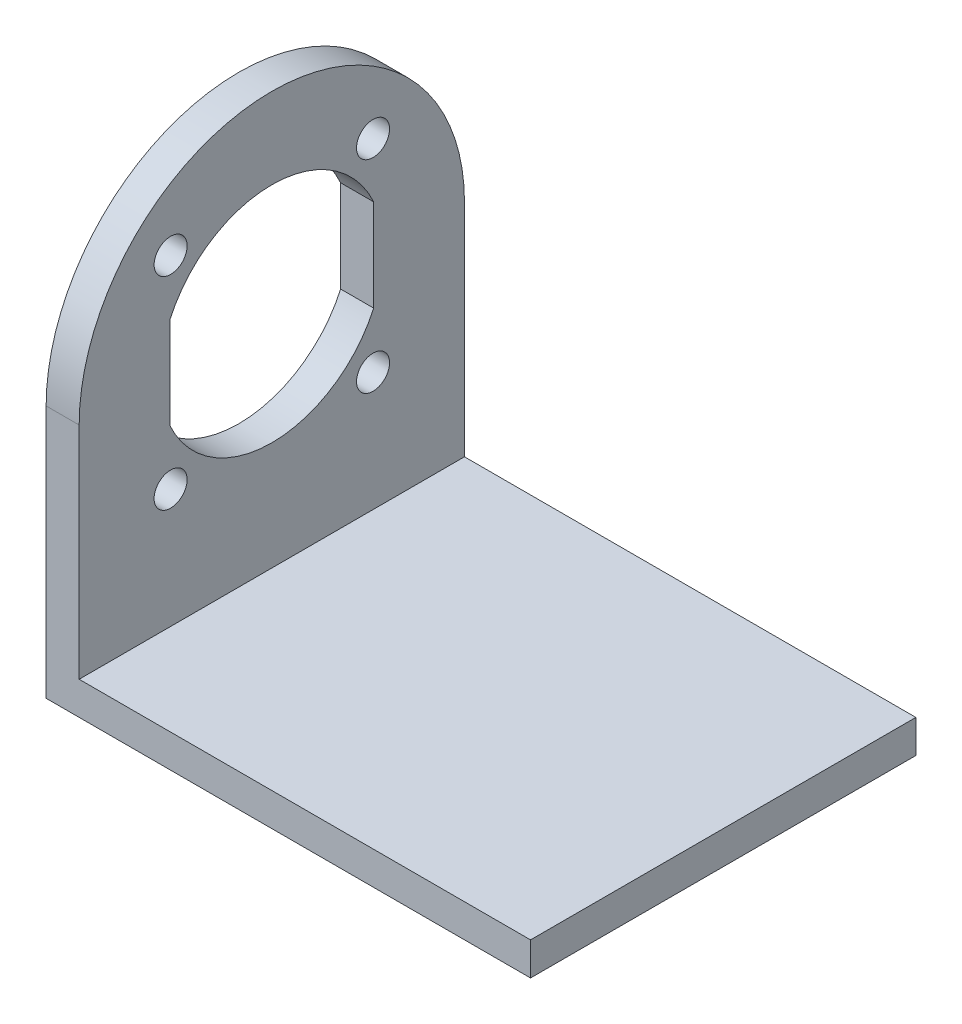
SolidWorks part; units mm, degrees
ref_plane "Front Plane" through (0, 0, 0) normal (0, 0, 1) x (1, 0, 0)
ref_plane "Top Plane" through (0, 0, 0) normal (0, 1, 0) x (1, 0, 0)
ref_plane "Right Plane" through (0, 0, 0) normal (1, 0, 0) x (0, 0, -1)
sketch "Sketch1" plane through (0, 0, 0) normal (0, 0, 1) x (1, 0, 0)
  line L0 (0, 0) -> (0, 40.5)
  line L1 (0, 40.5) -> (3, 40.5)
  line L2 (3, 40.5) -> (3, 3)
  line L3 (3, 3) -> (44, 3)
  line L4 (44, 3) -> (44, 0)
  line L5 (44, 0) -> (0, 0)
  dimension "D1" = 40.5
  dimension "D2" = 3
  dimension "D3" = 3
  dimension "D4" = 44
extrude "Boss-Extrude1" add sketch "Sketch1" along normal mid plane 35
sketch "Sketch2" plane through (0, 0, 0) normal (-1, 0, 0) x (0, 0, 1)
  line L0 (0, 0) -> (0, 23) construction
  line L1 (-9.25, 23) -> (9.25, 23)
  line L2 (-9.25, 27.1785) -> (-9.25, 18.8215)
  line L3 (9.25, 27.1785) -> (9.25, 18.8215)
  line L4 (-17.5, 23) -> (-17.5, 40.5)
  line L5 (-17.5, 40.5) -> (17.5, 40.5)
  line L6 (17.5, 40.5) -> (17.5, 23)
  line L7 (-9.1924, 13.8076) -> (9.1924, 32.1924) construction
  arc A0 (-9.25, 18.8215) -> (9.25, 18.8215) centre (0, 23) ccw
  arc A1 (9.25, 27.1785) -> (-9.25, 27.1785) centre (0, 23) ccw
  circle A2 centre (0, 23) radius 17.5
  circle A3 centre (9.1924, 32.1924) radius 1.5
  circle A4 centre (-9.1924, 13.8076) radius 1.5
  circle A5 centre (9.1924, 13.8076) radius 1.5
  circle A6 centre (-9.1924, 32.1924) radius 1.5
  point P7 (0, 23)
  point P10 (-9.25, 23)
  point P13 (9.25, 23)
  point P23 (0, 23)
  dimension "D2" = 20.3
  dimension "D4" = 35
  dimension "D6" = 3
  dimension "D7" = 3
  dimension "D1" = 23
  dimension "D3" = 18.5
  dimension "D5" = 26
extrude "Cut-Extrude1" cut sketch "Sketch2" against normal blind 35 contours L2 A0 L3 L1 | L3 A1 L2 L1 | A6 | A3 | A4 | A5 | A2 L5 M12 | A2 M14 M15
